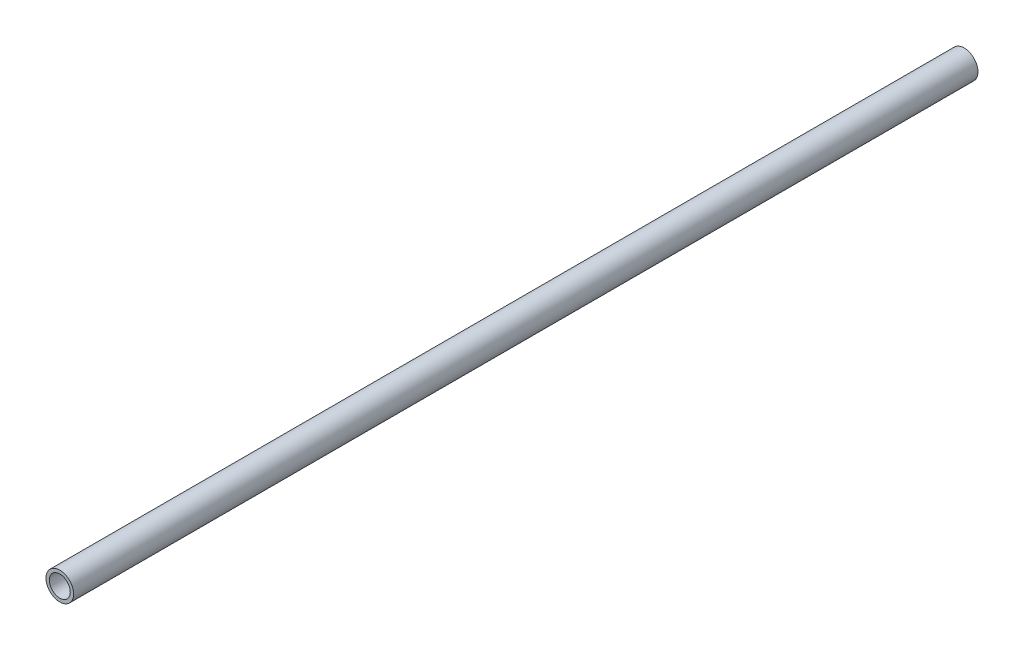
SolidWorks part; units mm, degrees
ref_plane "Face" through (0, 0, 0) normal (0, 0, 1) x (1, 0, 0)
ref_plane "Dessus" through (0, 0, 0) normal (0, 1, 0) x (1, 0, 0)
ref_plane "Droite" through (0, 0, 0) normal (1, 0, 0) x (0, 0, -1)
sketch "Esquisse1" plane through (0, 0, 0) normal (0, 0, 1) x (1, 0, 0)
  circle A0 centre (0, 0) radius 1.65
  circle A1 centre (0, 0) radius 1.25
  dimension "D1" = 3.3
  dimension "D2" = 2.5
extrude "Extrusion1" add sketch "Esquisse1" along normal blind 108
